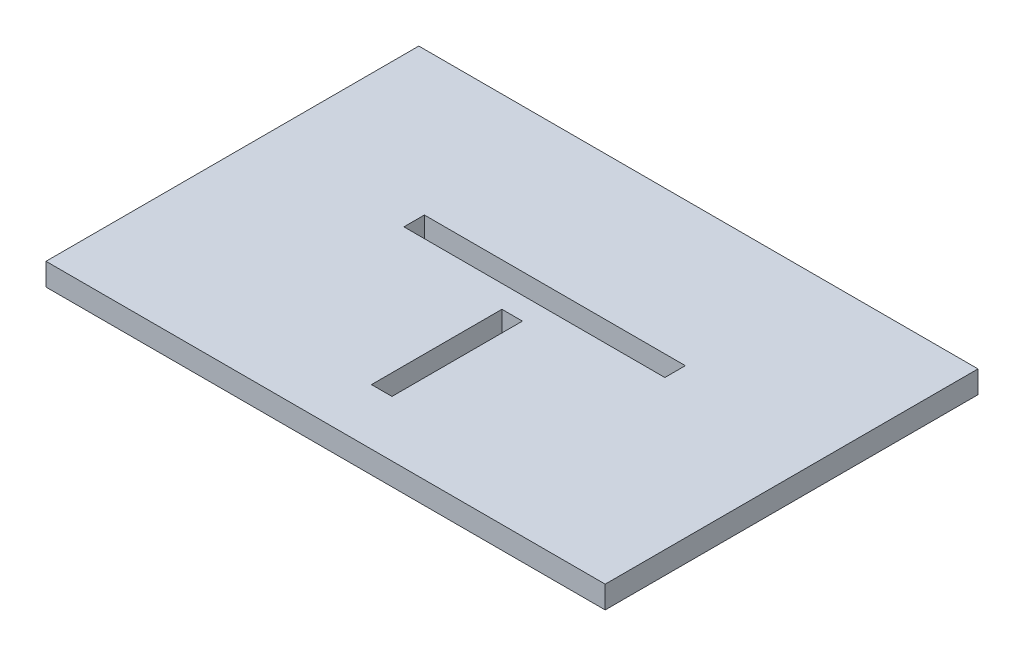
SolidWorks part; units mm, degrees
ref_plane "Front Plane" through (0, 0, 0) normal (0, 0, 1) x (1, 0, 0)
ref_plane "Top Plane" through (0, 0, 0) normal (0, 1, 0) x (1, 0, 0)
ref_plane "Right Plane" through (0, 0, 0) normal (1, 0, 0) x (0, 0, -1)
sketch "Sketch1" plane through (0, 0, 0) normal (0, 1, 0) x (1, 0, 0)
  line L0 (0.05, 0) -> (-49999.95, 0) construction
  line L1 (-75, 50) -> (75, 50)
  line L2 (-75, 50) -> (-75, -50)
  line L3 (-75, -50) -> (75, -50)
  line L4 (75, 50) -> (75, -50)
  line L5 (0, 0) -> (0, 50000) construction
  line L7 (-2.7, 2) -> (-2.7, -35) construction
  line L8 (35, 6) -> (-35, 6) construction
  line L9 (-2.7, 0) -> (2.8, 0)
  line L10 (-2.7, 0) -> (-2.7, -35)
  line L11 (-2.7, -35) -> (2.8, -35)
  line L12 (2.8, 0) -> (2.8, -35)
  line L15 (0, 8.9) -> (0, 6) construction
  line L17 (-35, 11.5) -> (35, 11.5)
  line L18 (-35, 11.5) -> (-35, 6)
  line L19 (-35, 6) -> (35, 6)
  line L20 (35, 11.5) -> (35, 6)
  line L23 (-35, 11.5) -> (-35, 6) construction
  point P0 (0, 0)
  point P8 (0.05, 0)
  point P15 (0, 0)
  point P19 (0, 8.9)
  dimension "D1" = 150
  dimension "D2" = 100
  dimension "D3" = 40
  dimension "D5" = 5.5
  dimension "D6" = 15
  dimension "D7" = 35
  dimension "D8" = 6
  dimension "D9" = 5.5
extrude "Boss-Extrude1" add sketch "Sketch1" along normal blind 6
